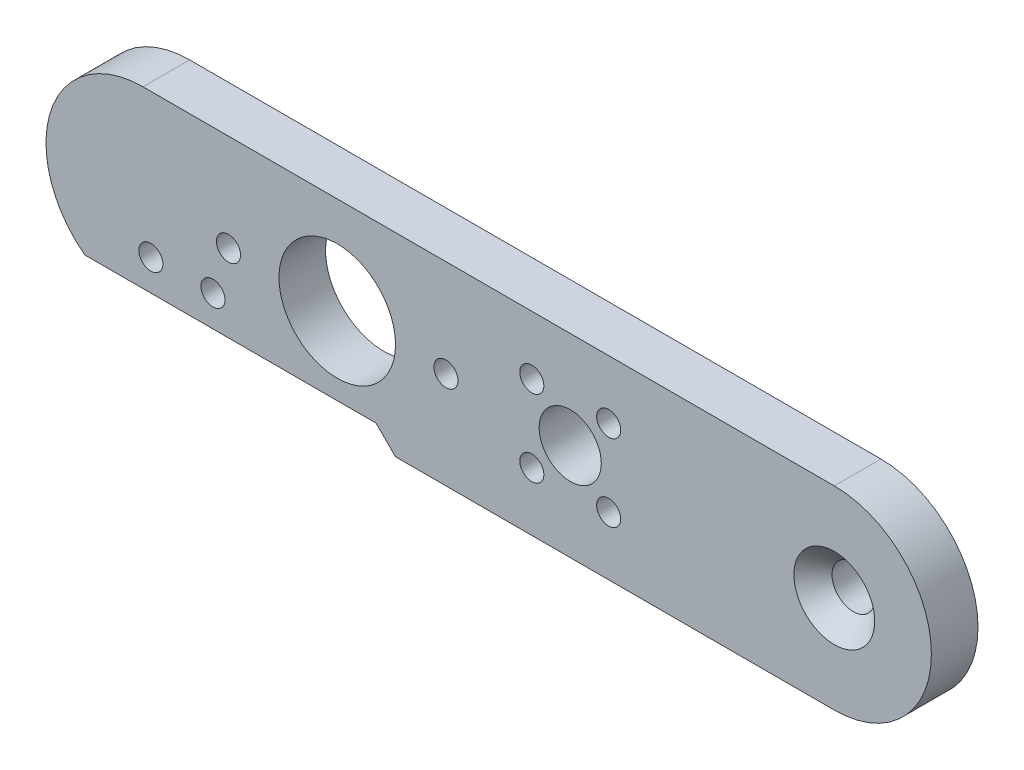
SolidWorks part; units mm, degrees
ref_plane "Front Plane" through (0, 0, 0) normal (0, 0, 1) x (1, 0, 0)
ref_plane "Top Plane" through (0, 0, 0) normal (0, 1, 0) x (1, 0, 0)
ref_plane "Right Plane" through (0, 0, 0) normal (1, 0, 0) x (0, 0, -1)
sketch "Sketch1" plane through (0, 0, 0) normal (0, 0, 1) x (1, 0, 0)
  line L0 (44.5, 0) -> (-44.5, 0) construction
  line L1 (44.5, -12.5) -> (-12, -12.5)
  line L2 (44.5, 12.5) -> (-44.5, 12.5)
  line L3 (10.5, 0) -> (10.5, 7) construction
  line L4 (10.5, 0) -> (17.5, 0) construction
  line L5 (10.5, 0) -> (15.4497, 4.9497) construction
  line L6 (3.5, 0) -> (17.5, 0) construction
  line L7 (10.5, 0) -> (5.5503, -4.9497) construction
  line L8 (10.5, 0) -> (15.4497, -4.9497) construction
  line L9 (-52, -10) -> (-14.5, -10)
  line L10 (-14.5, -10) -> (-12, -12.5)
  arc A0 (44.5, -12.5) -> (44.5, 12.5) centre (44.5, 0) ccw
  arc A1 (-44.5, 12.5) -> (-52, -10) centre (-44.5, 0) ccw
  circle A2 centre (10.5, 0) radius 4
  circle A3 centre (10.5, 0) radius 7 construction
  circle A4 centre (15.4497, 4.9497) radius 1.55
  circle A5 centre (5.5503, 4.9497) radius 1.55
  circle A6 centre (15.4497, -4.9497) radius 1.55
  circle A7 centre (5.5503, -4.9497) radius 1.55
  circle A8 centre (-19.5, 0) radius 7.5
  circle A9 centre (-5.5, 0) radius 1.55
  circle A10 centre (-33.5, 0) radius 1.55
  point P2 (0, 0)
  dimension "D2" = 12.5
  dimension "D3" = 8
  dimension "D5" = 14
  dimension "D7" = 3.1
  dimension "D10" = 3.1
  dimension "D13" = 3.1
  dimension "D14" = 3.1
  dimension "D17" = 15
  dimension "D1" = 89
  dimension "D4" = 34
  dimension "D6" = 45
  dimension "D8" = 45
  dimension "D9" = 45
  dimension "D11" = 59
  dimension "D12" = 22.5
  dimension "D15" = 14
  dimension "D16" = 14
  dimension "D18" = 30
extrude "Boss-Extrude1" add sketch "Sketch1" along normal blind 6
hole_wizard "CSK for M5 Flat Head Machine Screw1" positions "Sketch3" profile "Sketch4" countersink size "M5" standard "ANSI Metric"
sketch "Sketch3" plane through (0, 0, 6) normal (0, 0, 1) x (1, 0, 0)
  point P0 (44.5, 0)
sketch "Sketch4" plane through (44.5, 0, 6) normal (1, 0, 0) x (0, -1, 0)
  line L0 (0, 0) -> (0, 6)
  line L1 (0, 6) -> (2.75, 6)
  line L2 (2.75, 6) -> (2.75, 2.45)
  line L3 (2.75, 2.45) -> (5.2, 0)
  line L5 (5.2, 0) -> (0, 0)
  line L6 (-2.75, 2.45) -> (-5.2, 0) construction
  line L11 (0, -6.35) -> (0, 107.95) construction
  dimension "Thru Hole Dia." = 5.5
  dimension "Thru Hole Depth" = 6
  dimension "Near C'Sink Dia." = 10.4
  dimension "Near C'Sink Angle" = 90
sketch "Sketch5" plane through (0, 0, 6) normal (0, 0, 1) x (1, 0, 0)
  line L0 (-49.9994, -6) -> (-25.0807, -6) construction
  line L1 (44.5, 12.5) -> (-44.5, 12.5) construction
  circle A0 centre (-35.5, -6) radius 1.55
  circle A1 centre (-43.5, -6) radius 1.55
  dimension "D2" = 3.1
  dimension "D3" = 3.1
  dimension "D1" = 18.5
  dimension "D4" = 16
  dimension "D5" = 8
extrude "Cut-Extrude1" cut sketch "Sketch5" against normal blind 3
sketch "Sketch6" plane through (0, 0, 3) normal (0, 0, 1) x (1, 0, 0)
  circle A0 centre (-43.5, -6) radius 3
  circle A1 centre (-35.5, -6) radius 3
  dimension "D1" = 6
extrude "Cut-Extrude2" cut sketch "Sketch6" against normal through all
